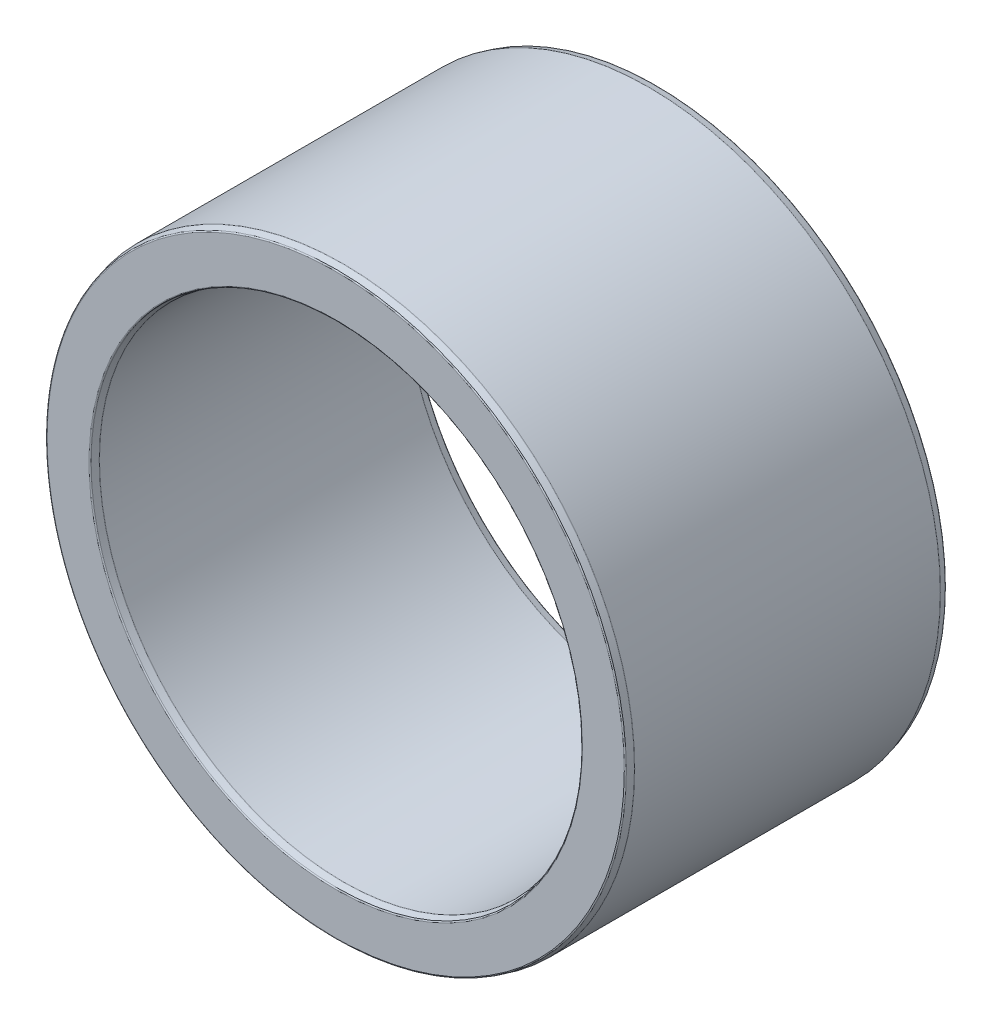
SolidWorks part; units mm, degrees
ref_plane "Front Plane" through (0, 0, 0) normal (0, 0, 1) x (1, 0, 0)
ref_plane "Top Plane" through (0, 0, 0) normal (0, 1, 0) x (1, 0, 0)
ref_plane "Right Plane" through (0, 0, 0) normal (1, 0, 0) x (0, 0, -1)
sketch "Sketch1" plane through (0, 0, 0) normal (0, 0, 1) x (1, 0, 0)
  circle A0 centre (0, 0) radius 25.085
  circle A1 centre (0, 0) radius 30
  dimension "D1" = 50.17
  dimension "D2" = 60
extrude "Boss-Extrude1" add sketch "Sketch1" along normal mid plane 32.9946
chamfer "Chamfer1" distance 0.762 angle 15 4 edges at (25.085, 0, 16.4973) (30, 0, -16.4973) (25.085, 0, -16.4973) (30, 0, 16.4973)
fillet "Fillet1" radius 0.127 8 edges at (25.2892, 0, -16.4973) (25.085, 0, -15.7353) (30, 0, -15.7353) (29.7958, 0, -16.4973) (30, 0, 15.7353) (29.7958, 0, 16.4973) (25.085, 0, 15.7353) (25.2892, 0, 16.4973)
